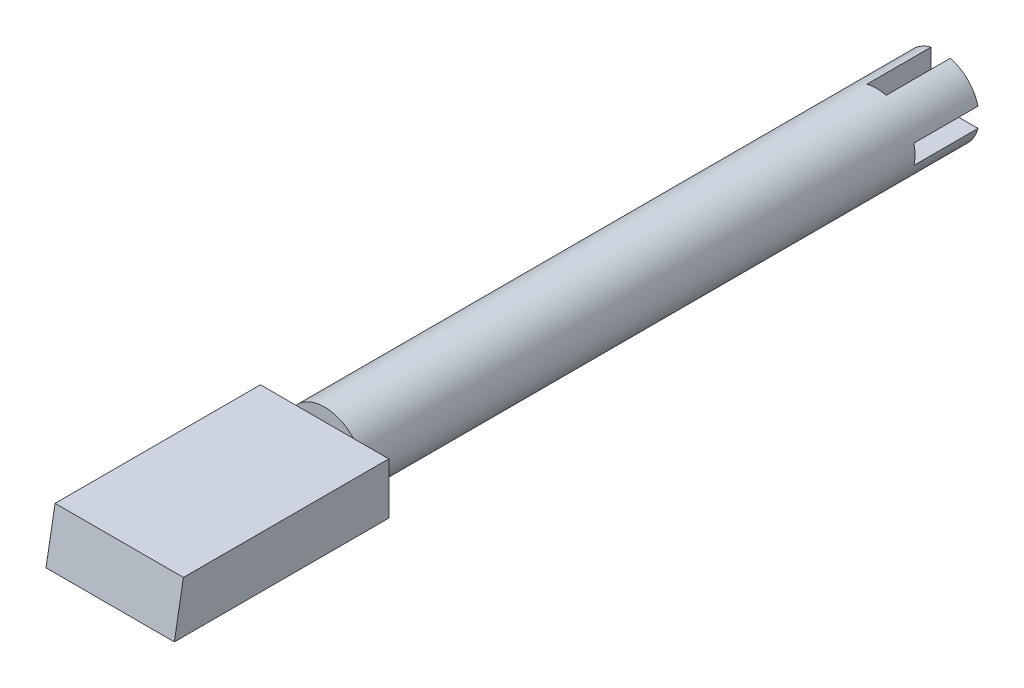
SolidWorks part; units mm, degrees
ref_plane "前视基准面" through (0, 0, 0) normal (0, 0, 1) x (1, 0, 0)
ref_plane "上视基准面" through (0, 0, 0) normal (0, 1, 0) x (1, 0, 0)
ref_plane "右视基准面" through (0, 0, 0) normal (1, 0, 0) x (0, 0, -1)
sketch "草图1" plane through (0, 0, 0) normal (0, 0, 1) x (1, 0, 0)
  circle A0 centre (0, 0) radius 3
  dimension "D1" = 6
extrude "凸台-拉伸1" add sketch "草图1" along normal blind 48
sketch "草图2" plane through (0, 0, 0) normal (1, 0, 0) x (0, 0, -1)
  line L0 (-48, 2) -> (-64, 2)
  line L1 (-48, 3) -> (-48, -3) construction
  line L2 (-64, 2) -> (-64.7053, -2)
  line L3 (-64.7053, -2) -> (-48, -2)
  line L4 (-48, -2) -> (-48, 2)
  line L5 (-48, 0) -> (-64.3527, 0) construction
  line L6 (-48, 0) -> (0, 0) construction
  dimension "D1" = 80
  dimension "D2" = 4
  dimension "D3" = 16
extrude "凸台-拉伸2" add sketch "草图2" along normal mid plane 10
sketch "草图3" plane through (0, 0, 0) normal (0, 0, -1) x (-1, 0, 0)
  line L1 (0.75, 2.9047) -> (-0.75, 2.9047)
  line L2 (0.75, 2.9047) -> (0.75, -2.9047)
  line L3 (0.75, -2.9047) -> (-0.75, -2.9047)
  line L4 (-0.75, 2.9047) -> (-0.75, -2.9047)
  line L5 (0.75, 2.9047) -> (-0.75, -2.9047) construction
  line L6 (0.75, -2.9047) -> (-0.75, 2.9047) construction
  line L7 (2.9047, 0.75) -> (-2.9047, 0.75)
  line L8 (2.9047, 0.75) -> (2.9047, -0.75)
  line L9 (2.9047, -0.75) -> (-2.9047, -0.75)
  line L10 (-2.9047, 0.75) -> (-2.9047, -0.75)
  line L11 (2.9047, 0.75) -> (-2.9047, -0.75) construction
  line L12 (2.9047, -0.75) -> (-2.9047, 0.75) construction
  circle A0 centre (0, 0) radius 3 construction
  circle A1 centre (0, 0) radius 3
  point P0 (0, 0)
  dimension "D1" = 1.5
  dimension "D2" = 1.5
extrude "切除-拉伸2" cut sketch "草图3" against normal blind 5 contours L7 L2 L1 L4 | L1 M3 | L3 M3 | L2 L9 L4 L3 | L7 L10 L9 L4 | L9 L8 L7 L2 | L8 M3 | L10 M3 | L9 L2 L7 L4
